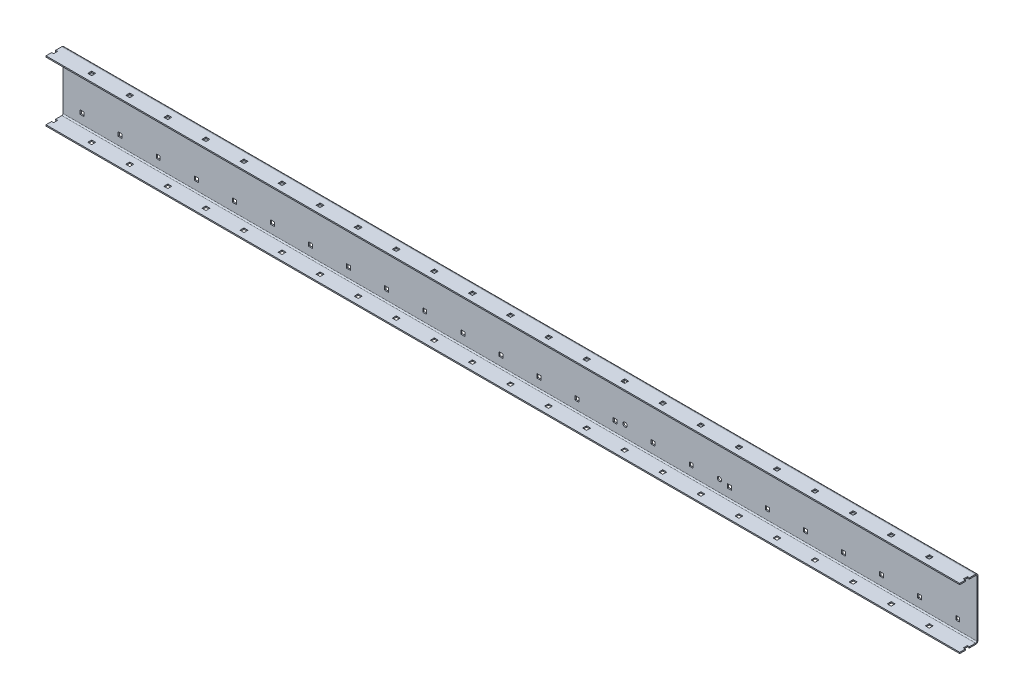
SolidWorks part; units mm, degrees
ref_plane "Front" through (0, 0, 0) normal (0, 0, 1) x (1, 0, 0)
ref_plane "Top" through (0, 0, 0) normal (0, 1, 0) x (1, 0, 0)
ref_plane "Right" through (0, 0, 0) normal (1, 0, 0) x (0, 0, -1)
sketch "Esquisse1" plane through (0, 0, 0) normal (0, 0, 1) x (1, 0, 0)
  line L1 (0, 100) -> (3000, 100)
  line L2 (0, 100) -> (0, -100)
  line L3 (0, -100) -> (3000, -100)
  line L4 (3000, 100) -> (3000, -100)
  dimension "longeur chassi" = 3000
  dimension "hauteur chassi" = 200
  dimension "D3" = 100
extrude "Base-Extrusion" add sketch "Esquisse1" along normal blind 60
sketch "Esquisse2" plane through (0, 0, 60) normal (0, 0, 1) x (1, 0, 0)
  line L1 (0, 96) -> (3000, 96)
  line L2 (0, 96) -> (0, -96)
  line L3 (0, -96) -> (3000, -96)
  line L4 (3000, 96) -> (3000, -96)
  line L5 (0, -100) -> (3000, -100) construction
  line L6 (0, 100) -> (0, -100) construction
  dimension "D1" = 192
  dimension "D2" = 4
  dimension "D4" = 3000
extrude "Enlèv. mat.-Extru.1" cut sketch "Esquisse2" against normal blind 56
sketch "Esquisse4" plane through (0, 0, 4) normal (0, 0, 1) x (1, 0, 0)
  line L0 (62.5, 74.6944) -> (62.5, 48.8766) construction
  line L1 (56, 66.5) -> (69, 66.5)
  line L2 (56, 66.5) -> (56, 53.5)
  line L3 (56, 53.5) -> (69, 53.5)
  line L4 (69, 66.5) -> (69, 53.5)
  line L5 (50.6788, 60) -> (73.5404, 60) construction
  line L6 (0, 96) -> (0, -96) construction
  line L8 (3000, 100) -> (0, 100) construction
  line L147 (-15.4194, 0) -> (3060.0811, 0) construction
  line L148 (62.5, -46.6389) -> (62.5, -67.8292) construction
  line L149 (56, -53.5) -> (69, -53.5)
  line L150 (56, -53.5) -> (56, -66.5)
  line L151 (56, -66.5) -> (69, -66.5)
  line L152 (69, -53.5) -> (69, -66.5)
  line L161 (73.5404, -60) -> (46.3913, -60) construction
  line L162 (0, -100) -> (3000, -100) construction
  dimension "D1" = 13
  dimension "D2" = 13
  dimension "D3" = 6.5
  dimension "D4" = 6.5
  dimension "D5" = 62.5
  dimension "D6" = 40
  dimension "D124" = 13
  dimension "D127" = 13
  dimension "D130" = 6.5
  dimension "D131" = 6.5
  dimension "D132" = 40
extrude "Enlèv. mat.-Extru.3" cut sketch "Esquisse4" against normal through all
sketch "Esquisse6" plane through (0, -100, 0) normal (0, -1, 0) x (1, 0, 0)
  line L0 (-49.3497, 35) -> (3046.7993, 35) construction
  line L1 (0, 60) -> (0, 4) construction
  line L9 (-6.5, 41.5) -> (6.5, 41.5)
  line L10 (-6.5, 41.5) -> (-6.5, 28.5)
  line L11 (-6.5, 28.5) -> (6.5, 28.5)
  line L12 (6.5, 41.5) -> (6.5, 28.5)
  line L13 (0, 60) -> (3000, 60) construction
  dimension "D7" = 13
  dimension "D9" = 6.5
  dimension "D10" = 13
  dimension "D11" = 25
  dimension "D128" = 6.5
extrude "Enlèv. mat.-Extru.4" cut sketch "Esquisse6" against normal through all
sheet metal parameters "Tôlerie 1" parameters "D1"=4, "Epaisseur"=4
bend "Pli dans angle2" bend angle 90 parameters "D1"=0, "D5"=1
flatten bends "Dépliage 1" parameters "D1"=4
sketch "Esquisse-Angle1" plane through (0, 0, 4) normal (0, 0, 1) x (1, 0, 0)
  line L0 (3000, 95.1479) -> (0, 95.1479) construction
  line L1 (0, -95.1479) -> (3000, -95.1479) construction
bend "Pli dans angle1" bend angle 90 parameters "D1"=0, "D5"=2
process bends "Pliage 1" parameters "D1"=0
sketch "Esquisse-Plate1" plane through (0, 0, 4) normal (0, 0, 1) x (1, 0, 0)
pattern_linear "Répétition linéaire1" count 24 spacing 125 along (1, 0, 0) of "Enlèv. mat.-Extru.3"
pattern_linear "Répétition linéaire2" count 25 spacing 125 along (1, 0, 0) of "Enlèv. mat.-Extru.4"
sketch "Esquisse7" plane through (0, 0, 0) normal (0, 0, -1) x (-1, 0, 0)
  line L0 (-3000, 100) -> (0, 100) construction
  line L1 (-3000, -92) -> (-3000, 92) construction
  circle A0 centre (-2155, -54) radius 7
  circle A2 centre (-2155, 66) radius 7
  circle A3 centre (-1845, 66) radius 7
  circle A6 centre (-1845, -54) radius 7
  dimension "D1" = 14
  dimension "D2" = 14
  dimension "D3" = 14
  dimension "D4" = 14
  dimension "D7" = 310
  dimension "D8" = 120
  dimension "D5" = 34
  dimension "D6" = 120
  dimension "D9" = 34
  dimension "D10" = 845
extrude "Enlèv. mat.-Extru.5" cut sketch "Esquisse7" against normal blind 10
